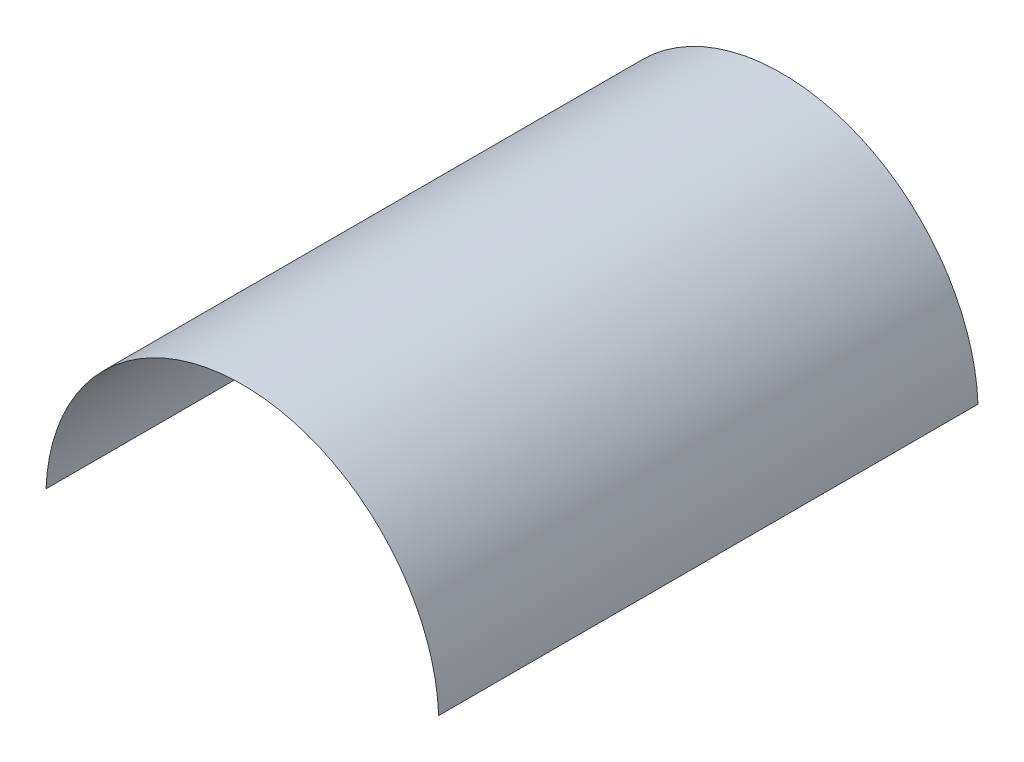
SolidWorks part; units mm, degrees
ref_plane "Front" through (0, 0, 0) normal (0, 0, 1) x (1, 0, 0)
ref_plane "Top" through (0, 0, 0) normal (0, 1, 0) x (1, 0, 0)
ref_plane "Right" through (0, 0, 0) normal (1, 0, 0) x (0, 0, -1)
sketch "Sketch1" plane through (0, 0, 0) normal (0, 0, 1) x (1, 0, 0)
  arc A0 (0, 0) -> (86.2138, 0) centre (43.1069, -40.3163) cw
surface "Surface-Extrude1" sketch "Sketch1" parameters "D1"=78
surface "Surface-Extend2" parameters "D1"=42
